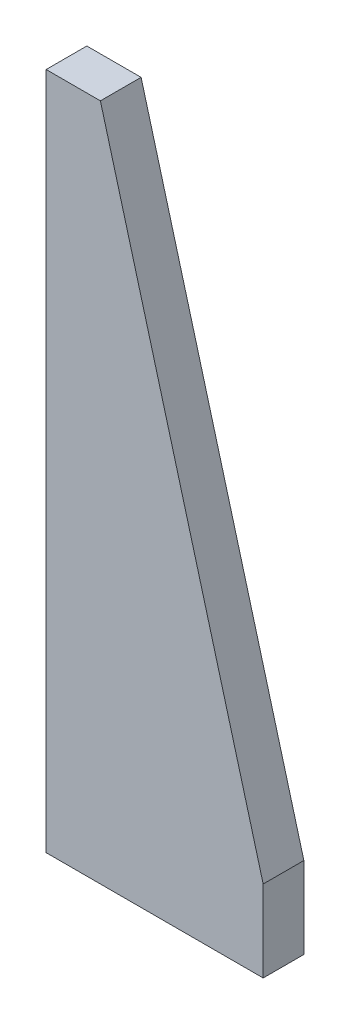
SolidWorks part; units mm, degrees
ref_plane "Front Plane" through (0, 0, 0) normal (0, 0, 1) x (1, 0, 0)
ref_plane "Top Plane" through (0, 0, 0) normal (0, 1, 0) x (1, 0, 0)
ref_plane "Right Plane" through (0, 0, 0) normal (1, 0, 0) x (0, 0, -1)
sketch "Sketch1" plane through (0, 0, 0) normal (0, 0, 1) x (1, 0, 0)
  line L0 (80, 0) -> (0, 0)
  line L1 (0, 0) -> (0, 250)
  line L3 (0, 250) -> (20, 250)
  line L4 (80, 0) -> (80, 30)
  line L5 (80, 30) -> (20, 250)
  dimension "D1" = 250
  dimension "D2" = 80
  dimension "D3" = 20
  dimension "D4" = 30
extrude "Boss-Extrude1" add sketch "Sketch1" along normal blind 15
